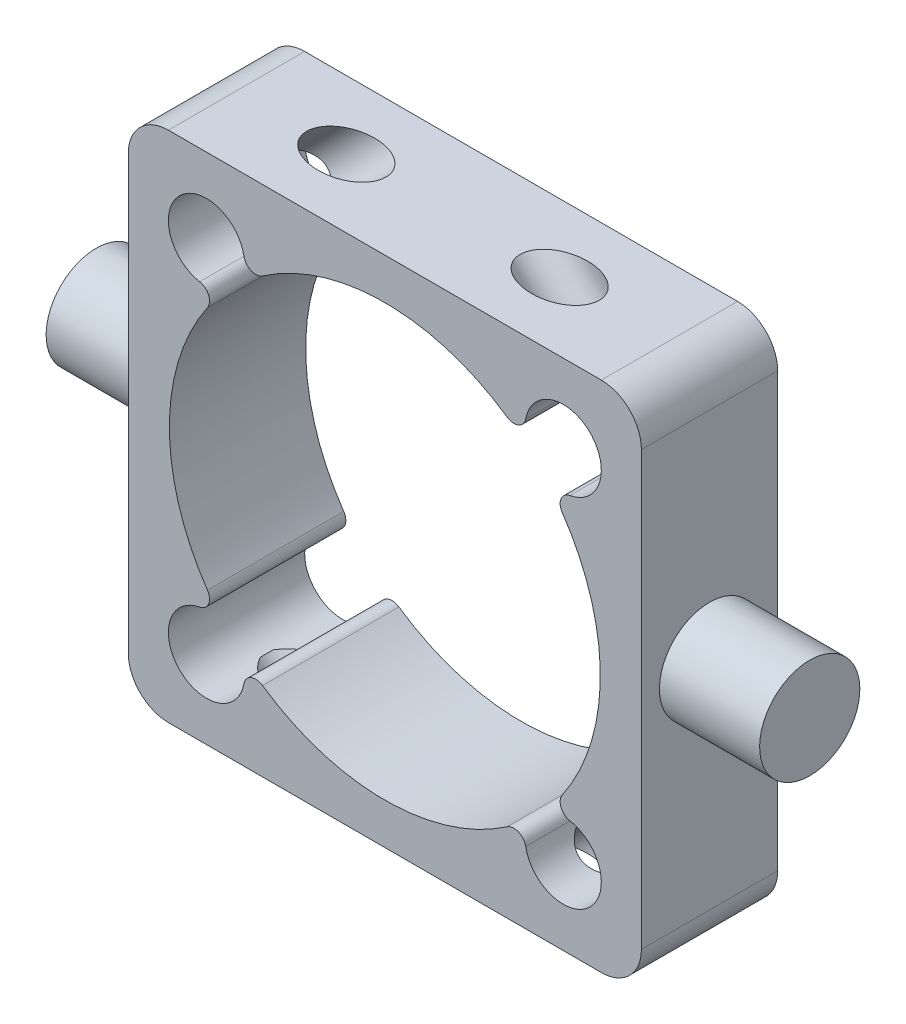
SolidWorks part; units mm, degrees
ref_plane "Plano frontal" through (0, 0, 0) normal (0, 0, 1) x (1, 0, 0)
ref_plane "Plano superior" through (0, 0, 0) normal (0, 1, 0) x (1, 0, 0)
ref_plane "Plano direito" through (0, 0, 0) normal (1, 0, 0) x (0, 0, -1)
sketch "Esboço1" plane through (0, 0, 0) normal (0, 0, 1) x (1, 0, 0)
  line L0 (0, 24.4094) -> (0, -31.769) construction
  line L1 (-64, 64) -> (64, 64)
  line L2 (-64, 64) -> (-64, -64)
  line L3 (-64, -64) -> (64, -64)
  line L4 (64, 64) -> (64, -64)
  line L5 (-35.6169, 0) -> (36.185, 0) construction
  arc A0 (-44.2597, 30.4983) -> (-44.2597, -30.4983) centre (0, 0) ccw
  arc A1 (-35.1524, 46.1948) -> (-46.1948, 35.1524) centre (-44.5, 44.5) ccw
  arc A2 (46.1948, 35.1524) -> (35.1524, 46.1948) centre (44.5, 44.5) ccw
  arc A3 (35.1524, -46.1948) -> (46.1948, -35.1524) centre (44.5, -44.5) ccw
  arc A4 (-46.1948, -35.1524) -> (-35.1524, -46.1948) centre (-44.5, -44.5) ccw
  arc A5 (30.4983, 44.2597) -> (-30.4983, 44.2597) centre (0, 0) ccw
  arc A6 (44.2597, -30.4983) -> (44.2597, 30.4983) centre (0, 0) ccw
  arc A7 (-30.4983, -44.2597) -> (30.4983, -44.2597) centre (0, 0) ccw
  arc A8 (-35.1524, 46.1948) -> (-30.4983, 44.2597) centre (-32.2005, 46.73) ccw
  arc A9 (-44.2597, 30.4983) -> (-46.1948, 35.1524) centre (-46.73, 32.2005) ccw
  arc A10 (-30.4983, -44.2597) -> (-35.1524, -46.1948) centre (-32.2005, -46.73) ccw
  arc A11 (-46.1948, -35.1524) -> (-44.2597, -30.4983) centre (-46.73, -32.2005) ccw
  arc A12 (30.4983, -44.2597) -> (35.1524, -46.1948) centre (32.2005, -46.73) cw
  arc A13 (44.2597, -30.4983) -> (46.1948, -35.1524) centre (46.73, -32.2005) ccw
  arc A14 (44.2597, 30.4983) -> (46.1948, 35.1524) centre (46.73, 32.2005) cw
  arc A15 (30.4983, 44.2597) -> (35.1524, 46.1948) centre (32.2005, 46.73) ccw
  point P28 (-36.3825, -39.5649)
  point P35 (39.5649, -36.3825)
  point P40 (36.3825, 39.5649)
  dimension "D2" = 107.5
  dimension "D4" = 19
  dimension "D6" = 3
  dimension "D1" = 128
  dimension "D3" = 89
  dimension "D5" = 89
extrude "Extrusão1" add sketch "Esboço1" along normal blind 34
sketch "Esboço2" plane through (-64, 0, 0) normal (-1, 0, 0) x (0, 0, 1)
  line L0 (17, 64) -> (17, -64) construction
  line L1 (34, 64) -> (0, 64) construction
  line L2 (34, -64) -> (0, -64) construction
  line L3 (0, 0) -> (34, 0) construction
  line L4 (0, 64) -> (0, -64) construction
  line L5 (34, 64) -> (34, -64) construction
  circle A0 centre (17, 0) radius 12.5
  dimension "D1" = 25
extrude "Extrusão2" add sketch "Esboço2" along normal blind 25
mirror "Espelhar1" about plane through (0, 0, 0) normal (1, 0, 0) of "Extrusão2"
fillet "Filete2" radius 10 4 edges at (-64, 64, 17) (64, 64, 17) (64, -64, 17) (-64, -64, 17)
ref_plane "Plano1" through (0, 0, 0) normal (1, 0, 0) x (0, 0, -1)
ref_plane "Plano2" through (5.5212, -5.5212, 0) normal (0.7071, -0.7071, 0) x (0.7071, 0.7071, 0)
ref_plane "Plano3" through (-33.3697, 33.3697, 0) normal (0.7071, -0.7071, 0) x (0.7071, 0.7071, 0)
sketch "Esboço6" plane through (-33.3697, 33.3697, 0) normal (0.7071, -0.7071, 0) x (0.7071, 0.7071, 0)
  line L0 (31.9952, 17) -> (-1.9393, 17) construction
  line L1 (83.4386, 0) -> (7.0711, 0) construction
  line L2 (83.4386, 34) -> (7.0711, 34) construction
  line L3 (7.0711, 0) -> (7.0711, 34) construction
  circle A0 centre (64.0711, 17) radius 7
  dimension "D1" = 14
  dimension "D2" = 57
extrude "Extrusão5" cut sketch "Esboço6" along normal blind 42
mirror "Espelhar2" about plane through (0, 0, 0) normal (1, 0, 0) of "Extrusão5"
mirror "Espelhar3" about plane through (0, 0, 0) normal (0, 1, 0) of "Espelhar2", "Extrusão5"
